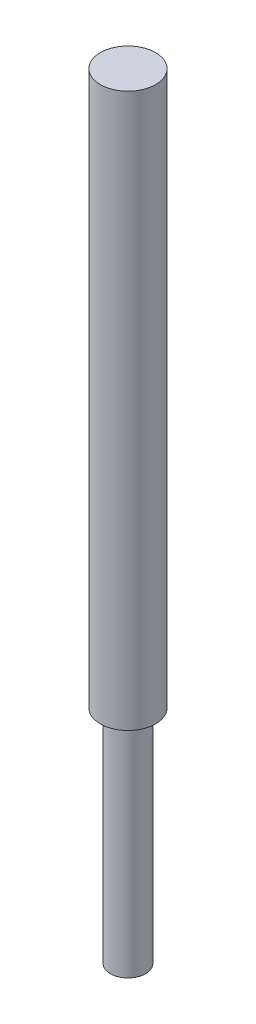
SolidWorks part; units mm, degrees
ref_plane "Front Plane" through (0, 0, 0) normal (0, 0, 1) x (1, 0, 0)
ref_plane "Top Plane" through (0, 0, 0) normal (0, 1, 0) x (1, 0, 0)
ref_plane "Right Plane" through (0, 0, 0) normal (1, 0, 0) x (0, 0, -1)
sketch "Sketch1" plane through (0, 0, 0) normal (0, 1, 0) x (1, 0, 0)
  circle A0 centre (0, 0) radius 6.35
  dimension "D1" = 12.7
extrude "Boss-Extrude1" add sketch "Sketch1" along normal blind 80
sketch "Sketch2" plane through (0, 80, 0) normal (0, 1, 0) x (1, 0, 0)
  circle A0 centre (0, 0) radius 10
  dimension "D1" = 20
extrude "Boss-Extrude2" add sketch "Sketch2" along normal blind 200
